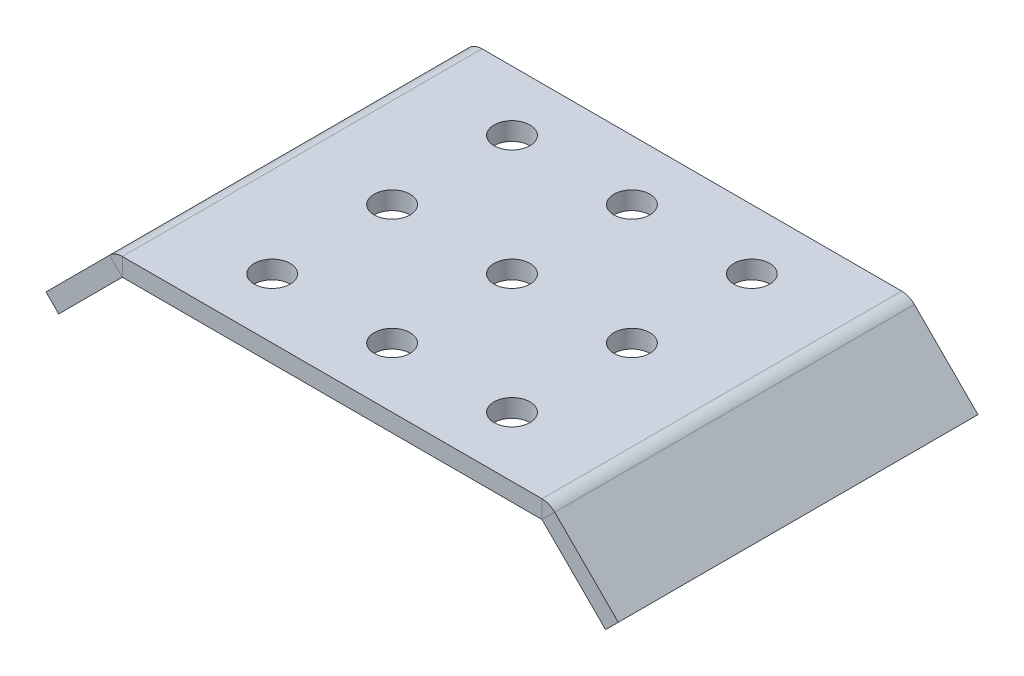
SolidWorks part; units mm, degrees
ref_plane "Front Plane" through (0, 0, 0) normal (0, 0, 1) x (1, 0, 0)
ref_plane "Top Plane" through (0, 0, 0) normal (0, 1, 0) x (1, 0, 0)
ref_plane "Right Plane" through (0, 0, 0) normal (1, 0, 0) x (0, 0, -1)
sketch "Sketch1" plane through (0, 0, 0) normal (0, 1, 0) x (1, 0, 0)
  line L0 (70, 60) -> (70, 0) construction
  line L1 (0, 0) -> (100, 0)
  line L2 (0, 0) -> (0, 60)
  line L3 (0, 60) -> (100, 60)
  line L4 (100, 0) -> (100, 60)
  line L5 (50, 60) -> (50, 0) construction
  line L6 (30, 60) -> (30, 0) construction
  circle A0 centre (70, 30) radius 3
  circle A1 centre (50, 30) radius 3
  circle A2 centre (30, 30) radius 3
  circle A3 centre (30, 50) radius 3
  circle A4 centre (50, 50) radius 3
  circle A5 centre (70, 50) radius 3
  circle A6 centre (70, 10) radius 3
  circle A7 centre (50, 10) radius 3
  circle A8 centre (30, 10) radius 3
  dimension "D5" = 6
  dimension "D6" = 10
  dimension "D7" = 10
  dimension "D8" = 10
  dimension "D9" = 10
  dimension "D10" = 10
  dimension "D11" = 10
  dimension "D1" = 60
  dimension "D2" = 100
  dimension "D3" = 30
  dimension "D4" = 30
sheet metal parameters "Sheet-Metal1" thickness 3 parameters "D1"=1
base flange "Base-Flange1" sketch "Sketch1" thickness 3 reverse thickness direction yes parameters "D1"=1
sketch "Sketch3" plane through (0, 3, 0) normal (0, 1, 0) x (1, 0, 0)
  line L0 (15, 60) -> (15, 0)
  line L1 (100, 60) -> (0, 60) construction
  line L2 (0, 0) -> (100, 0) construction
  line L3 (85, 60) -> (85, 0)
  line L4 (100, 0) -> (100, 60) construction
  line L5 (0, 60) -> (0, 0) construction
  dimension "D1" = 15
  dimension "D2" = 15
sketched bend "Sketched Bend1" parameters "D1"=0.001
bend "SketchBend1" bend radius 0.001 bend angle 45 parameters "D5"=1
bend "SketchBend2" bend radius 0.001 bend angle 45 parameters "D5"=2
flat pattern "Flat-Pattern1"
sketch "Bend-Lines1" plane through (0, 0, 0) normal (0, 1, 0) x (-1, 0, 0)
bend of the flat pattern "Flatten-<SketchBend1>1"
bend of the flat pattern "Flatten-<SketchBend2>1"
